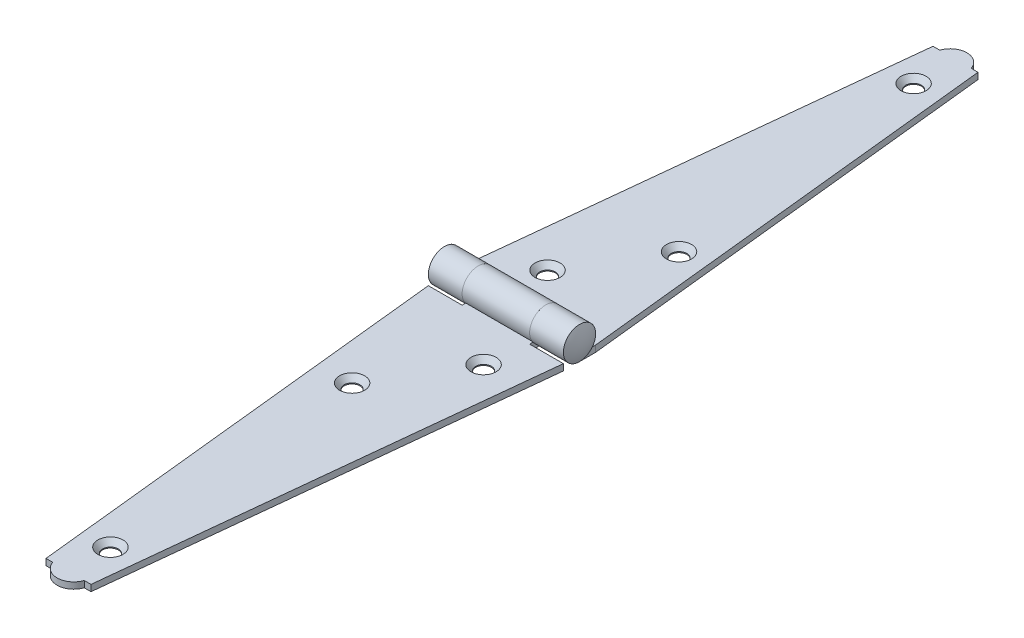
SolidWorks part; units mm, degrees
ref_plane "Front" through (0, 0, 0) normal (0, 0, 1) x (1, 0, 0)
ref_plane "Top" through (0, 0, 0) normal (0, 1, 0) x (1, 0, 0)
ref_plane "Right" through (0, 0, 0) normal (1, 0, 0) x (0, 0, -1)
sketch "Sketch1" plane through (0, 0, 0) normal (1, 0, 0) x (0, 0, -1)
  line L0 (0, 0) -> (-101.6, 0)
  line L1 (-101.6, 0) -> (-101.6, 1.4224)
  line L2 (-101.6, 1.4224) -> (0, 1.4224)
  line L3 (0, 1.4224) -> (101.6, 1.4224)
  line L4 (101.6, 1.4224) -> (101.6, 0)
  line L5 (101.6, 0) -> (0, 0)
  circle A0 centre (0, 3.6052) radius 3.6052
  circle A1 centre (0, 3.6052) radius 2.1828
sketch "Sketch2" plane through (0, 0, 0) normal (1, 0, 0) x (0, 0, -1)
  line L0 (0, 0) -> (-101.6, 0)
  line L1 (-101.6, 0) -> (-101.6, 1.4224)
  line L2 (-101.6, 1.4224) -> (0, 1.4224)
  line L3 (-3.0459, 1.6764) -> (-1.8441, 2.4374)
  arc A0 (0, 0) -> (-3.0459, 1.6764) centre (0, 3.6052) ccw
  circle A1 centre (0, 3.6052) radius 3.6052 construction
  arc A2 (0, 1.4224) -> (-1.8441, 2.4374) centre (0, 3.6052) ccw
  circle A3 centre (0, 3.6052) radius 2.1828 construction
  dimension "D1" = 0.254
extrude "Extrude1" add sketch "Sketch2" along normal mid plane 30.1625
sketch "Sketch3" plane through (0, 0, 0) normal (0, 1, 0) x (1, 0, 0)
  line L0 (-15.0812, 0) -> (-7.5406, 0) construction
  line L1 (-7.5406, 0) -> (0, 0) construction
  line L2 (0, 0) -> (7.5406, 0) construction
  line L3 (7.5406, 0) -> (15.0813, 0) construction
  line L4 (-15.0812, 0) -> (-15.0812, -101.6) construction
  line L5 (15.0812, 3.6052) -> (-15.0812, 3.6052) construction
  line L6 (7.5406, 3.6052) -> (15.0812, 3.6052)
  line L7 (-7.5406, 3.6052) -> (-7.5406, -3.6052)
  line L8 (15.0812, 3.6052) -> (15.0812, -3.6052)
  line L9 (7.5406, 3.6052) -> (7.5406, -3.6052)
  line L10 (-15.0812, -3.6052) -> (15.0812, -3.6052) construction
  line L11 (15.0812, -3.6052) -> (7.5406, -3.6052)
  line L12 (-7.5406, 3.6052) -> (-15.0812, 3.6052)
  line L13 (-15.0812, 3.6052) -> (-15.0812, -3.6052)
  line L14 (-15.0812, -3.6052) -> (-7.5406, -3.6052)
extrude "Cut-Extrude1" cut sketch "Sketch3" along normal through all
sketch "Sketch4" plane through (0, 0, 0) normal (1, 0, 0) x (0, 0, -1)
  line L0 (0, 0) -> (101.6, 0)
  line L1 (101.6, 0) -> (101.6, 1.4224)
  line L2 (101.6, 1.4224) -> (0, 1.4224)
  line L3 (0, 1.4224) -> (0, 3.6052) construction
  line L4 (3.0459, 1.6764) -> (1.8441, 2.4374)
  arc A0 (0, 0) -> (3.0459, 1.6764) centre (0, 3.6052) cw
  circle A1 centre (0, 3.6052) radius 3.6052 construction
  arc A2 (0, 1.4224) -> (1.8441, 2.4374) centre (0, 3.6052) cw
  circle A3 centre (0, 3.6052) radius 2.1828 construction
extrude "Extrude2" add sketch "Sketch4" along normal up to surface and the other way up to surface separate body
sketch "Sketch6" plane through (0, 0, 0) normal (0, 1, 0) x (1, 0, 0)
  line L1 (-7.5406, 3.6052) -> (7.5406, 3.6052)
  line L2 (-7.5406, 3.6052) -> (-7.5406, -3.6052)
  line L3 (-7.5406, -3.6052) -> (7.5406, -3.6052)
  line L4 (7.5406, 3.6052) -> (7.5406, -3.6052)
extrude "Cut-Extrude3" cut sketch "Sketch6" along normal through all
ref_plane "Plane1" through (0, 3.6052, 0) normal (0, 1, 0) x (-1, 0, 0)
sketch "Sketch7" plane through (0, 3.6052, 0) normal (0, 1, 0) x (-1, 0, 0)
  line L0 (-15.8433, 0) -> (15.8432, 0)
  line L1 (-15.0813, -3.6052) -> (-15.0813, -2.1828)
  line L2 (-15.0813, -2.1828) -> (15.0813, -2.1828)
  line L3 (15.0813, -2.1828) -> (15.0813, -3.6052)
  arc A0 (-15.8433, 0) -> (-15.0813, -3.6052) centre (-6.9337, 0) ccw
  arc A1 (15.0813, -3.6052) -> (15.8432, 0) centre (6.9337, 0) ccw
  dimension "D1" = 0.762
revolve "Revolve1" add sketch "Sketch7" angle 360 about L0
sketch "Sketch8" plane through (0, 1.4224, 0) normal (0, 1, 0) x (-1, 0, 0)
  line L0 (-3.519, -99.06) -> (-5.0271, -99.06)
  line L1 (3.519, -99.06) -> (5.0271, -99.06)
  line L2 (5.0271, -99.06) -> (15.0812, -3.6052)
  line L3 (15.0812, -3.6052) -> (40.4813, -3.6052)
  line L4 (40.4813, -3.6052) -> (40.4813, -126.9857)
  line L5 (40.4813, -126.9857) -> (-40.4813, -126.9857)
  line L6 (-40.4813, -126.9857) -> (-40.4813, -3.6052)
  line L7 (-40.4813, -3.6052) -> (-15.0812, -3.6052)
  line L8 (-15.0812, -3.6052) -> (-5.0271, -99.06)
  line L9 (0, -101.6) -> (0, 0) construction
  line L10 (-15.0813, -101.6) -> (15.0813, -101.6) construction
  line L11 (15.0813, -99.06) -> (5.0271, -99.06) construction
  line L12 (15.0813, 0) -> (15.0813, -101.6) construction
  line L13 (5.0271, -99.06) -> (-5.0271, -99.06) construction
  line L14 (-5.0271, -99.06) -> (-15.0813, -99.06) construction
  line L15 (-15.0813, -101.6) -> (-15.0813, 0) construction
  line L16 (15.0812, 0) -> (-15.0813, 0) construction
  line L17 (-3.519, 99.06) -> (-5.0271, 99.06)
  line L18 (3.519, 99.06) -> (5.0271, 99.06)
  line L19 (-15.0812, 3.6052) -> (-5.0271, 99.06)
  line L20 (-40.4813, 3.6052) -> (-15.0812, 3.6052)
  line L21 (-40.4812, 126.9857) -> (-40.4813, 3.6052)
  line L22 (40.4812, 126.9857) -> (-40.4812, 126.9857)
  line L23 (40.4813, 3.6052) -> (40.4812, 126.9857)
  line L24 (5.0271, 99.06) -> (15.0812, 3.6052)
  line L25 (15.0812, 3.6052) -> (40.4813, 3.6052)
  arc A0 (3.519, -99.06) -> (-3.519, -99.06) centre (0, -97.8924) cw
  arc A1 (3.519, 99.06) -> (-3.519, 99.06) centre (0, 97.8924) ccw
extrude "Cut-Extrude4" cut sketch "Sketch8" against normal blind 1056.132
sketch "Sketch9" plane through (0, 1.4224, 0) normal (0, 1, 0) x (-1, 0, 0)
  line L0 (0, -101.6) -> (0, 0) construction
  line L1 (0, 0) -> (0, 101.6) construction
  line L2 (15.0812, 0) -> (-15.0813, 0) construction
  line L3 (-6.35, -30.9562) -> (4.7625, -30.9562) construction
  arc A0 (-3.519, -99.06) -> (3.519, -99.06) centre (0, -97.8924) ccw construction
  circle A1 centre (0, -89.6938) radius 1.7526
  circle A3 centre (-6.35, -30.9562) radius 1.7526
  circle A4 centre (4.7625, -12.7) radius 1.7526
  circle A6 centre (-6.35, 12.7) radius 1.7526
  circle A7 centre (4.7625, 30.9562) radius 1.7526
  circle A10 centre (0, 89.6938) radius 1.7526
  point P0 (0, -89.6938)
  point P1 (0, 89.6938)
  point P4 (4.7625, -12.7)
  point P7 (-6.35, -30.9562)
  point P8 (-6.35, 12.7)
  point P9 (4.7625, 30.9562)
  point P10 (0, 101.6)
  point P13 (-0.7937, -30.9562)
  point P14 (0, -81.7563)
  point P15 (0, 81.7563)
  point P16 (0, -162.7188)
  point P17 (0, 162.7188)
  point P18 (0, -101.6)
extrude "Extrude6" cut sketch "Sketch9" against normal through all
chamfer "Chamfer1" distance 1.209 angle 41 3 edges at (0, 1.4224, 91.4463) (6.35, 1.4224, 14.4526) (-4.7625, 1.4224, 32.7088)
chamfer "Chamfer2" distance 1.209 angle 41 3 edges at (0, 1.4224, -87.9412) (6.35, 1.4224, -29.2036) (-4.7625, 1.4224, -10.9474)
sketch "Sketch10" [suppressed] plane through (0, 4.0132, 0) normal (0, 1, 0) x (1, 0, 0)
  circle A0 centre (33.3375, 34.925) radius 3.4036 construction
  circle A1 centre (0, 111.125) radius 3.4036
  circle A2 centre (0, -111.125) radius 3.4036
extrude "Extrude7" [suppressed] cut sketch "Sketch10" against normal through all
chamfer "Chamfer3" [suppressed] distance 2.54 angle 41
chamfer "Chamfer4" [suppressed] distance 2.54 angle 41
sketch "Sketch11" [suppressed] plane through (0, 4.0132, 0) normal (0, 1, 0) x (1, 0, 0)
  circle A0 centre (0, 190.5) radius 3.4036
  circle A1 centre (0, -190.5) radius 3.4036
  circle A2 centre (33.3375, 34.925) radius 3.4036 construction
extrude "Extrude8" [suppressed] cut sketch "Sketch11" against normal through all
chamfer "Chamfer5" [suppressed] distance 2.54 angle 41
chamfer "Chamfer6" [suppressed] distance 2.54 angle 41
equation "\"D2@Sketch1\" = \"Pin Dia@Sketch1\" + (2*\"Th@Sketch1\")"
equation "\"D1@Sketch8\" = \"D1@Extrude1\"*.05"
equation "\"D2@Sketch8\" = \"A@Sketch1\"*.025"
equation "\"D2@Sketch9\" = \"E@Sketch9\""
equation "\"D1@Sketch9\" = \"D@Sketch9\""
equation "\"D1@Chamfer1\" = \"Th@Sketch1\" * .85"
equation "\"D1@Chamfer2\" = \"D1@Chamfer1\""
